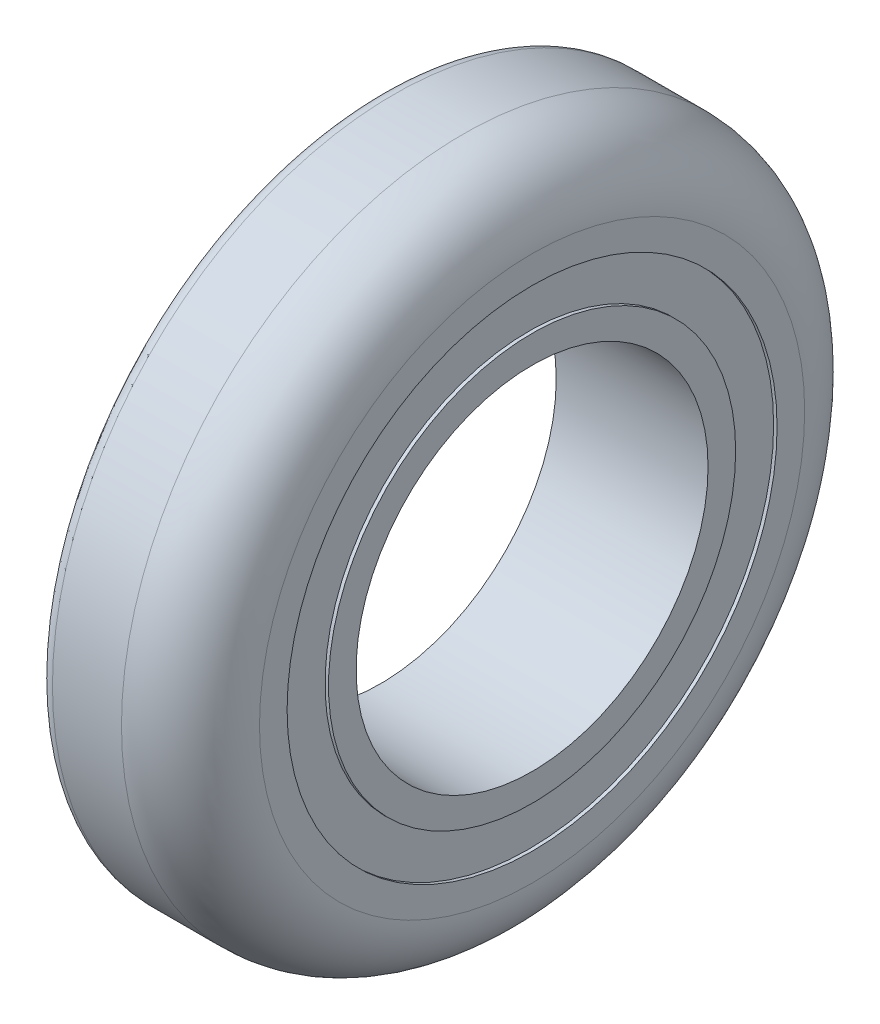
SolidWorks part; units mm, degrees
ref_plane "Front Plane" through (0, 0, 0) normal (0, 0, 1) x (1, 0, 0)
ref_plane "Top Plane" through (0, 0, 0) normal (0, 1, 0) x (1, 0, 0)
ref_plane "Right Plane" through (0, 0, 0) normal (1, 0, 0) x (0, 0, -1)
sketch "Sketch1" plane through (0, 0, 0) normal (1, 0, 0) x (0, 0, -1)
  circle A0 centre (0, 0) radius 25.5
  circle A1 centre (0, 0) radius 49.5
  dimension "D1" = 51
  dimension "D2" = 99
extrude "Boss-Extrude1" add sketch "Sketch1" along normal blind 22
fillet "Fillet1" radius 10 1 edges at (22, 0, -49.5)
fillet "Fillet2" radius 2 1 edges at (0, 0, -49.5)
sketch "Sketch2" plane through (22, 0, 0) normal (1, 0, 0) x (0, 0, -1)
  circle A1 centre (0, 0) radius 35.5
  circle A2 centre (0, 0) radius 29.5
  circle A3 centre (0, 0) radius 29.5
  circle A4 centre (0, 0) radius 39.5 construction
  dimension "D2" = 4
  dimension "D1" = 4
extrude "Cut-Extrude1" cut sketch "Sketch2" against normal blind 0.5
sketch "Sketch3" plane through (0, 0, 0) normal (-1, 0, 0) x (0, 0, 1)
  circle A1 centre (0, 0) radius 29.5
  circle A2 centre (0, 0) radius 29.5
  circle A3 centre (0, 0) radius 35.5
  circle A4 centre (0, 0) radius 35.5
  dimension "D1" = 0
  dimension "D2" = 0
extrude "Cut-Extrude2" cut sketch "Sketch3" against normal blind 0.5
